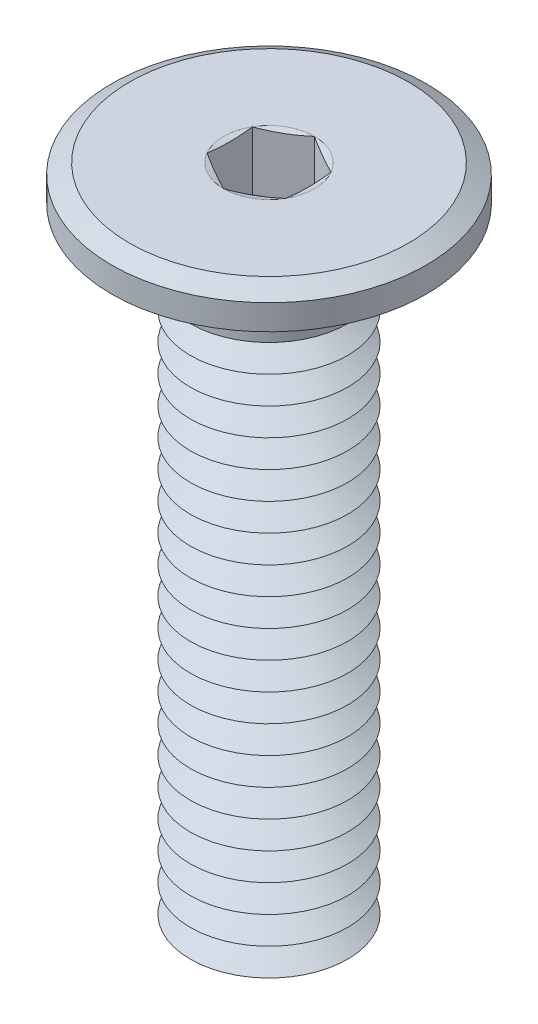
SolidWorks part; units mm, degrees
ref_plane "Front Plane" through (0, 0, 0) normal (0, 0, 1) x (1, 0, 0)
ref_plane "Top Plane" through (0, 0, 0) normal (0, 1, 0) x (1, 0, 0)
ref_plane "Right Plane" through (0, 0, 0) normal (1, 0, 0) x (0, 0, -1)
sketch "Sketch1" plane through (0, 0, 0) normal (0, 1, 0) x (1, 0, 0)
  circle A0 centre (0, 0) radius 4
  dimension "D1" = 8
extrude "Boss-Extrude1" add sketch "Sketch1" against normal blind 0.9
sketch "Sketch2" plane through (0, -0.9, 0) normal (0, -1, 0) x (1, 0, 0)
  circle A0 centre (0, 0) radius 2
  dimension "D1" = 4
extrude "Boss-Extrude2" add sketch "Sketch2" along normal blind 16
sketch "Sketch3" plane through (0, 0, 0) normal (1, 0, 0) x (0, 0, -1)
  line L0 (0, 0.9906) -> (0, -8.2999) construction
sketch "Sketch5" plane through (0, 0, 0) normal (1, 0, 0) x (0, 0, -1)
  line L0 (-2, -17.25) -> (-1.3938, -16.9)
  line L1 (-2, -0.9) -> (-2, -16.9) construction
  line L2 (-1.3938, -16.9) -> (-2, -16.55)
  line L3 (-2, -0.9) -> (-2, -16.9) construction
  line L4 (-2, -16.55) -> (-2, -17.25)
  line L6 (-2, -0.9) -> (-2, -16.9) construction
  line L7 (-2, -0.9) -> (-2, -16.9) construction
  line L14 (-2, -16.9) -> (2, -16.9) construction
  dimension "D1" = 0.7
revolve "Cut-Revolve1" cut sketch "Sketch5" angle 360 about L0
pattern_linear "LPattern1" count 21 spacing 0.7 along (0, 1, 0) of "Cut-Revolve1"
fillet "Fillet1" radius 0.2 1 edges at (0, -0.9, -2)
chamfer "Chamfer2" distance 0.45 angle 30 1 edges at (0, 0, 4)
sketch "Sketch6" plane through (0, 0, 0) normal (0, 1, 0) x (1, 0, 0)
  line L1 (0, 1.1547) -> (-1, 0.5774)
  line L2 (-1, 0.5774) -> (-1, -0.5774)
  line L3 (-1, -0.5774) -> (0, -1.1547)
  line L4 (0, -1.1547) -> (1, -0.5774)
  line L5 (1, -0.5774) -> (1, 0.5774)
  line L6 (1, 0.5774) -> (0, 1.1547)
  circle A0 centre (0, 0) radius 1 construction
  dimension "D1" = 2
extrude "Cut-Extrude1" cut sketch "Sketch6" against normal blind 1.5
sketch "Sketch7" plane through (0, -1.5, 0) normal (0, 1, 0) x (1, 0, 0)
  line L0 (-1, 0.5774) -> (-1, -0.5774) construction
  circle A0 centre (0, 0) radius 1
extrude "Cut-Extrude2" cut sketch "Sketch7" against normal through all draft 60
sketch "Sketch8" plane through (0, 0, 0) normal (0, 1, 0) x (1, 0, 0)
  circle A0 centre (0, 0) radius 1.1547
extrude "Cut-Extrude3" cut sketch "Sketch8" against normal through all draft 75
